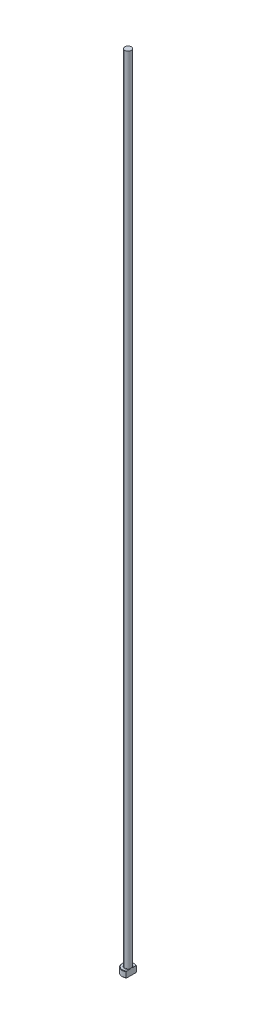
SolidWorks part; units mm, degrees
ref_plane "Front Plane" through (0, 0, 0) normal (0, 0, 1) x (1, 0, 0)
ref_plane "Top Plane" through (0, 0, 0) normal (0, 1, 0) x (1, 0, 0)
ref_plane "Right Plane" through (0, 0, 0) normal (1, 0, 0) x (0, 0, -1)
sketch "Sketch1" plane through (0, 0, 0) normal (0, 0, 1) x (1, 0, 0)
  line L0 (0, 259.9588) -> (0, -15.1925) construction
  line L1 (0, 0) -> (-3, 0)
  line L2 (-3, 0) -> (-3, 3)
  line L3 (-3, 3) -> (-1.6, 3)
  line L4 (-1.6, 3) -> (-1.6, 400)
  line L5 (-1.6, 400) -> (0, 400)
  line L6 (0, 400) -> (0, 0)
  dimension "L" = 400
  dimension "H" = 6
  dimension "T" = 3
  dimension "D" = 3.2
revolve "Revolve1" add sketch "Sketch1" angle 360 about L0
chamfer "Chamfer1" distance 0.2 angle 45 2 edges at (0, 3, 3) (0, 0, 3)
fillet "Fillet1" radius 0.2 1 edges at (0, 3, 1.6)
sketch "Sketch2" plane through (0, 0, 0) normal (0, 1, 0) x (1, 0, 0)
  line L0 (1.6, 2.5377) -> (1.6, -2.5377)
  circle A0 centre (0, 0) radius 3 construction
  arc A1 (1.6, -2.5377) -> (1.6, 2.5377) centre (0, 0) ccw
  circle A2 centre (0, 0) radius 1.6 construction
extrude "KEY" cut sketch "Sketch2" along normal through all
